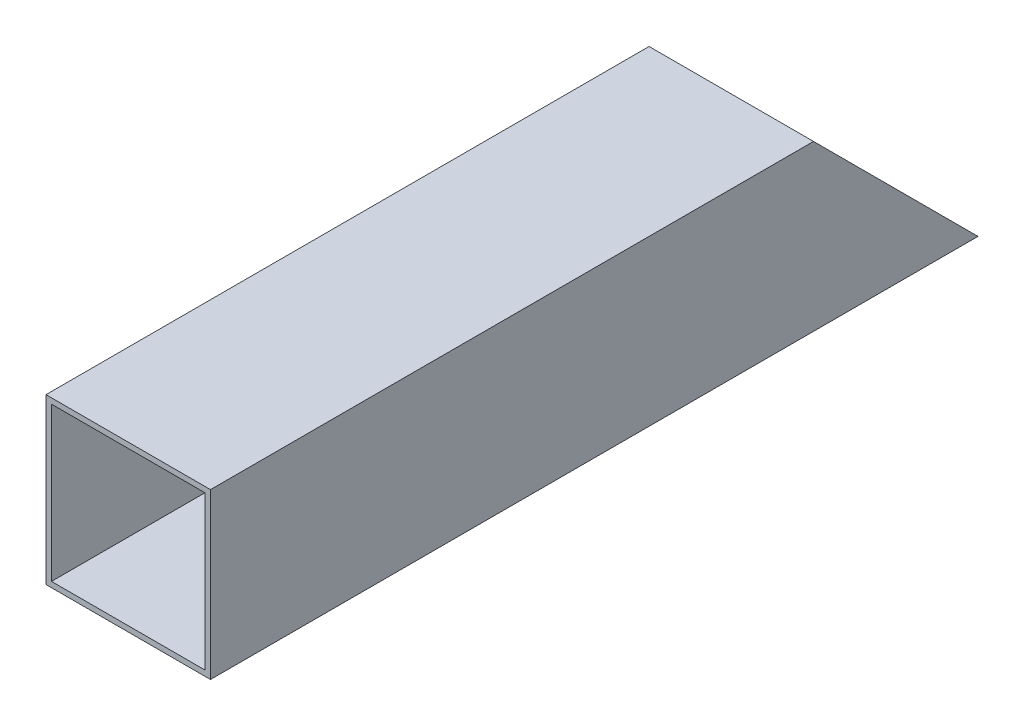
SolidWorks part; units mm, degrees
ref_plane "Piano frontale" through (0, 0, 0) normal (0, 0, 1) x (1, 0, 0)
ref_plane "Piano superiore" through (0, 0, 0) normal (0, 1, 0) x (1, 0, 0)
ref_plane "Piano destro" through (0, 0, 0) normal (1, 0, 0) x (0, 0, -1)
sketch "Schizzo1" plane through (0, 0, 0) normal (0, 0, 1) x (1, 0, 0)
  line L1 (-15, -15) -> (15, -15)
  line L2 (-15, -15) -> (-15, 15)
  line L3 (-15, 15) -> (15, 15)
  line L4 (15, -15) -> (15, 15)
  line L5 (-15, -15) -> (15, 15) construction
  line L6 (-15, 15) -> (15, -15) construction
  point P0 (0, 0)
  dimension "D1" = 30
  dimension "D2" = 30
extrude "Estrusione-Sottile1" add sketch "Schizzo1" along normal blind 140 thin
sketch "Schizzo3" plane through (-15, 0, 0) normal (-1, 0, 0) x (0, 0, 1)
  line L0 (0, -15) -> (30, 15)
  line L1 (140, 15) -> (0, 15) construction
  line L2 (30, 15) -> (30, 315) construction
  line L3 (30, 15) -> (0, 15)
  line L4 (0, 15) -> (0, -15)
  dimension "D1" = 45
extrude "Taglio-Estrusione1" cut sketch "Schizzo3" against normal up to next
